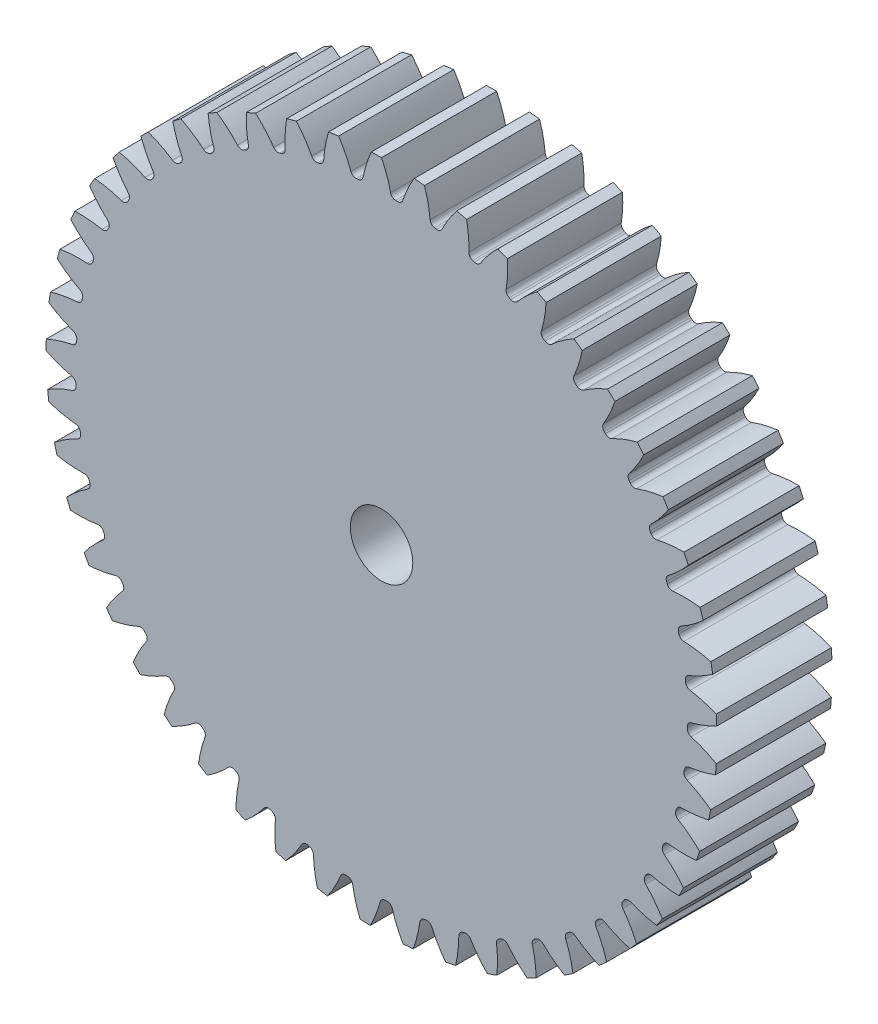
SolidWorks part; units mm, degrees
ref_plane "Front" through (0, 0, 0) normal (0, 0, 1) x (1, 0, 0)
ref_plane "Top" through (0, 0, 0) normal (0, 1, 0) x (1, 0, 0)
ref_plane "Right" through (0, 0, 0) normal (1, 0, 0) x (0, 0, -1)
sketch "Sketch3" plane through (0, 0, 0) normal (0, 0, 1) x (1, 0, 0)
  circle A0 centre (0, 0) radius 259.08
  dimension "od" = 518.16
extrude "gearBody" add sketch "Sketch3" along normal blind 88.9
sketch "Sketch2" plane through (0, 0, 0) normal (0, 0, 1) x (1, 0, 0)
  line L0 (0, 0) -> (216.1031, 89.5128) construction
  line L1 (258.6507, -17.1027) -> (0, 0) construction
  line L2 (0, 0) -> (36.3143, 0) construction
  line L3 (248.8916, 3.757) -> (248.6239, -12.1368) construction
  line L5 (248.7578, -4.1899) -> (0, 0) construction
  line L7 (0, 0) -> (233.9083, 0) construction
  arc A0 (233.9076, -0.5547) -> (233.7936, -7.3229) centre (0, 0) ccw construction
  arc A1 (258.9466, 8.3119) -> (258.5198, -17.0277) centre (0, 0) ccw construction
  arc A2 (248.8916, 3.757) -> (248.6239, -12.1368) centre (0, 0) ccw construction
  arc A3 (236.1734, -4.6904) -> (236.1974, -3.2659) centre (0, 0) ccw
  arc A4 (258.6507, -17.1027) -> (239.1293, -8.7361) centre (212.966, -96.7397) ccw
  arc A5 (258.6507, -17.1027) -> (259.08, 8.3824) centre (0, 0) ccw
  arc A6 (259.08, 8.3824) -> (239.2879, 0.678) centre (216.1031, 89.5128) cw
  arc A7 (236.1974, -3.2659) -> (239.2879, 0.678) centre (240.3321, -3.323) cw
  arc A8 (239.1293, -8.7361) -> (236.1734, -4.6904) centre (240.3077, -4.7725) cw
  point P6 (259.08, 8.3824)
  point P22 (258.6507, -17.1027)
  dimension "baseDia" = 467.8166
  dimension "od" = 518.16
  dimension "pd" = 497.84
  dimension "rd" = 472.44
  dimension "rFillet" = 4.1351
  dimension "pointX" = 259.08
  dimension "pointY" = 8.3824
  dimension "CTT" = 15.8937
  dimension "flankCenterAngle" = 22.5
extrude "toothCut" cut sketch "Sketch2" along normal through all
pattern_circular "CirPattern1" count 49 over 360 about axis through (0, 0, 0) along (0, 0, 1) of "toothCut"
sketch "hub1Dia" plane through (0, 0, 0) normal (0, 0, -1) x (-1, 0, 0)
  circle A0 centre (0, 0) radius 12.7
  dimension "hub1Dia" = 25.4
sketch "hub2Dia" plane through (0, 0, 88.9) normal (0, 0, 1) x (1, 0, 0)
  circle A0 centre (0, 0) radius 12.7
  dimension "hub2dia" = 25.4
sketch "boreDia" plane through (0, 0, 0) normal (0, 0, 1) x (1, 0, 0)
  circle A0 centre (0, 0) radius 24.13
  dimension "boreDia" = 48.26
extrude "bore" cut sketch "boreDia" against normal mid plane 25400
